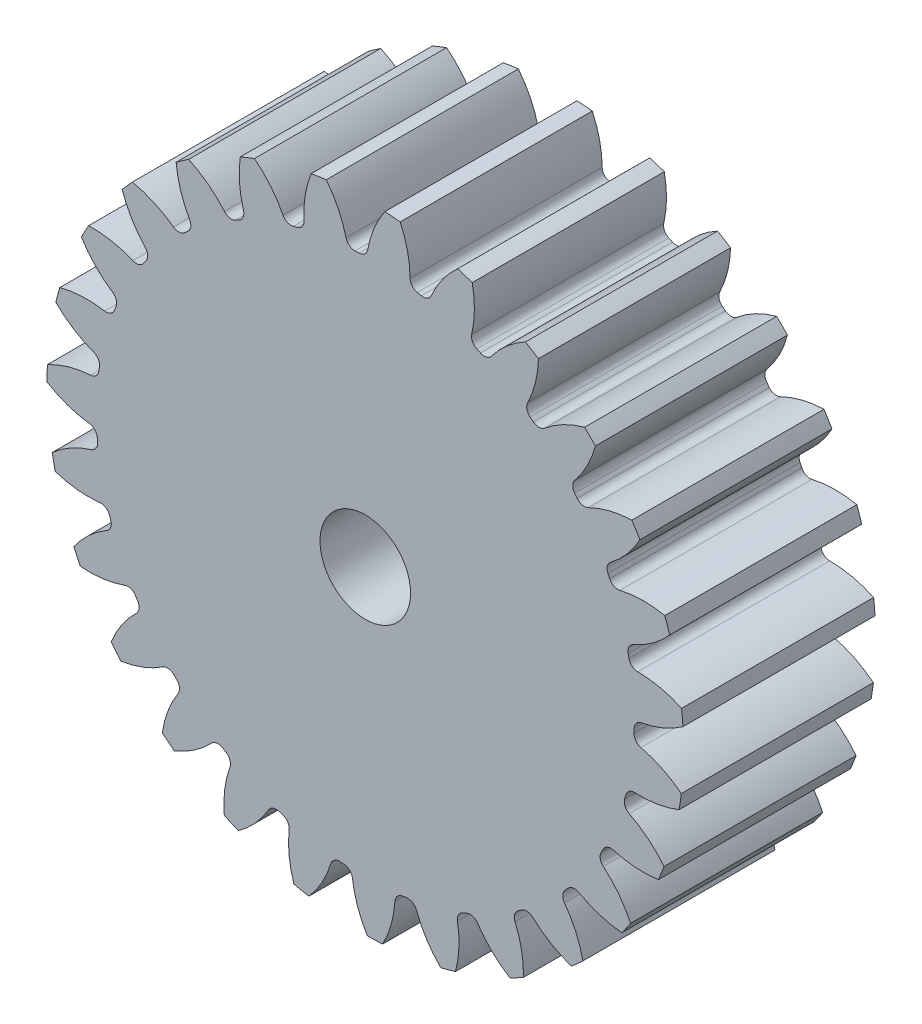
SolidWorks part; units mm, degrees
ref_plane "Front" through (0, 0, 0) normal (0, 0, 1) x (1, 0, 0)
ref_plane "Top" through (0, 0, 0) normal (0, 1, 0) x (1, 0, 0)
ref_plane "Right" through (0, 0, 0) normal (1, 0, 0) x (0, 0, -1)
sketch "Sketch3" plane through (0, 0, 0) normal (0, 0, 1) x (1, 0, 0)
  circle A0 centre (0, 0) radius 147.32
  dimension "od" = 294.64
extrude "gearBody" add sketch "Sketch3" along normal blind 88.9
sketch "Sketch2" plane through (0, 0, 0) normal (0, 0, 1) x (1, 0, 0)
  line L0 (0, 0) -> (119.0772, 49.3234) construction
  line L1 (146.5557, -17.8729) -> (0, 0) construction
  line L2 (0, 0) -> (36.3143, 0) construction
  line L3 (137.097, 4.1582) -> (136.657, -11.7355) construction
  line L5 (136.877, -3.7886) -> (0, 0) construction
  line L7 (0, 0) -> (128.8882, 0) construction
  arc A0 (128.8771, 1.6939) -> (128.5861, -8.8203) centre (0, 0) ccw construction
  arc A1 (147.012, 9.5208) -> (146.2603, -17.6383) centre (0, 0) ccw construction
  arc A2 (137.097, 4.1582) -> (136.657, -11.7355) centre (0, 0) ccw construction
  arc A3 (124.3825, -4.3919) -> (124.435, -2.4952) centre (0, 0) ccw
  arc A4 (146.5557, -17.8729) -> (127.5472, -8.5581) centre (116.1665, -55.8347) ccw
  arc A5 (146.5557, -17.8729) -> (147.32, 9.7387) centre (0, 0) ccw
  arc A6 (147.32, 9.7387) -> (127.8254, 1.4896) centre (119.0772, 49.3234) cw
  arc A7 (124.435, -2.4952) -> (127.8254, 1.4896) centre (128.5693, -2.5781) cw
  arc A8 (127.5472, -8.5581) -> (124.3825, -4.3919) centre (128.515, -4.5378) cw
  point P6 (147.32, 9.7387)
  point P22 (146.5557, -17.8729)
  dimension "baseDia" = 257.7765
  dimension "od" = 294.64
  dimension "pd" = 274.32
  dimension "rd" = 248.92
  dimension "rFillet" = 4.1351
  dimension "pointX" = 147.32
  dimension "pointY" = 9.7387
  dimension "CTT" = 15.8937
  dimension "flankCenterAngle" = 22.5
extrude "toothCut" cut sketch "Sketch2" along normal through all
pattern_circular "CirPattern1" count 27 over 360 about axis through (0, 0, 0) along (0, 0, 1) of "toothCut"
sketch "hub1Dia" plane through (0, 0, 0) normal (0, 0, -1) x (-1, 0, 0)
  circle A0 centre (0, 0) radius 12.7
  dimension "hub1Dia" = 25.4
sketch "hub2Dia" plane through (0, 0, 88.9) normal (0, 0, 1) x (1, 0, 0)
  circle A0 centre (0, 0) radius 12.7
  dimension "hub2dia" = 25.4
sketch "boreDia" plane through (0, 0, 0) normal (0, 0, 1) x (1, 0, 0)
  circle A0 centre (0, 0) radius 20.955
  dimension "boreDia" = 41.91
extrude "bore" cut sketch "boreDia" against normal mid plane 25400
